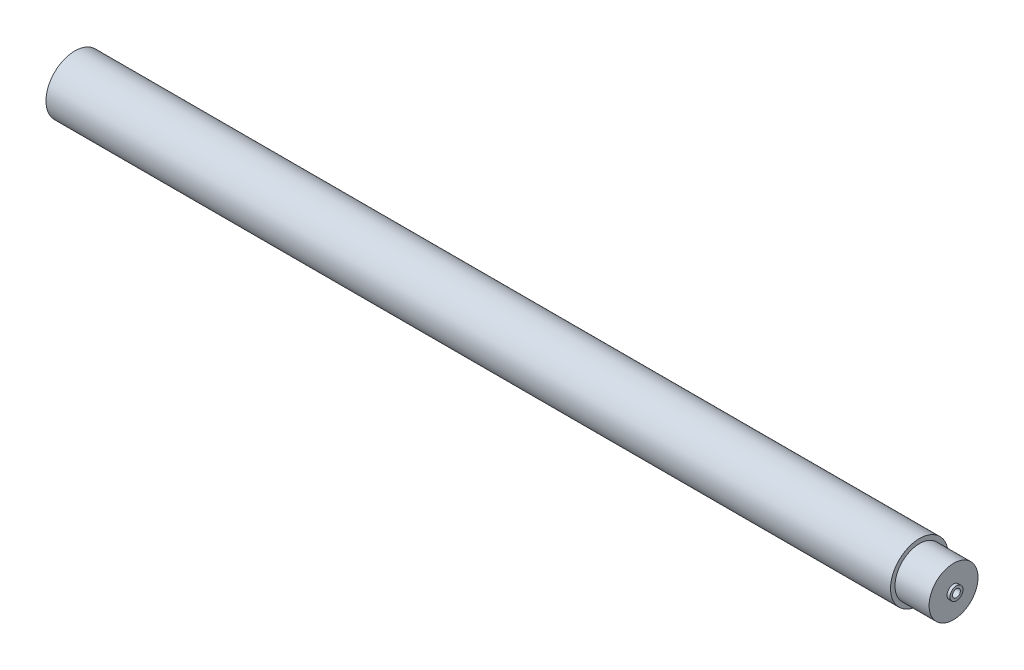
SolidWorks part; units mm, degrees
ref_plane "Plan de face" through (0, 0, 0) normal (0, 0, 1) x (1, 0, 0)
ref_plane "Plan de dessus" through (0, 0, 0) normal (0, 1, 0) x (1, 0, 0)
ref_plane "Plan de droite" through (0, 0, 0) normal (1, 0, 0) x (0, 0, -1)
sketch "Esquisse1" plane through (0, 0, 0) normal (1, 0, 0) x (0, 0, -1)
  circle A0 centre (0, 0) radius 44.5
  dimension "D1" = 89
extrude "Extrusion1" add sketch "Esquisse1" along normal blind 1300
sketch "Esquisse2" plane through (0, 0, 0) normal (-1, 0, 0) x (0, 0, 1)
  circle A0 centre (0, 0) radius 10
  dimension "D1" = 20
extrude "Extrusion2" add sketch "Esquisse2" along normal blind 3
sketch "Esquisse3" plane through (1300, 0, 0) normal (1, 0, 0) x (0, 0, -1)
  circle A0 centre (0, 0) radius 37.65
  dimension "D1" = 75.3
extrude "Extrusion3" add sketch "Esquisse3" along normal blind 52.5
sketch "Esquisse4" plane through (1352.5, 0, 0) normal (1, 0, 0) x (0, 0, -1)
  circle A0 centre (0, 0) radius 10
  dimension "D1" = 20
extrude "Extrusion4" add sketch "Esquisse4" along normal blind 4.5
sketch "Esquisse6" plane through (-3, 0, 0) normal (-1, 0, 0) x (0, 0, 1)
  circle A0 centre (0, 0) radius 5
extrude "Enlèv. mat.-Extru.1" cut sketch "Esquisse6" against normal blind 30
sketch "Esquisse7" plane through (1357, 0, 0) normal (1, 0, 0) x (0, 0, -1)
  circle A0 centre (0, 0) radius 6
extrude "Enlèv. mat.-Extru.2" cut sketch "Esquisse7" against normal blind 30
